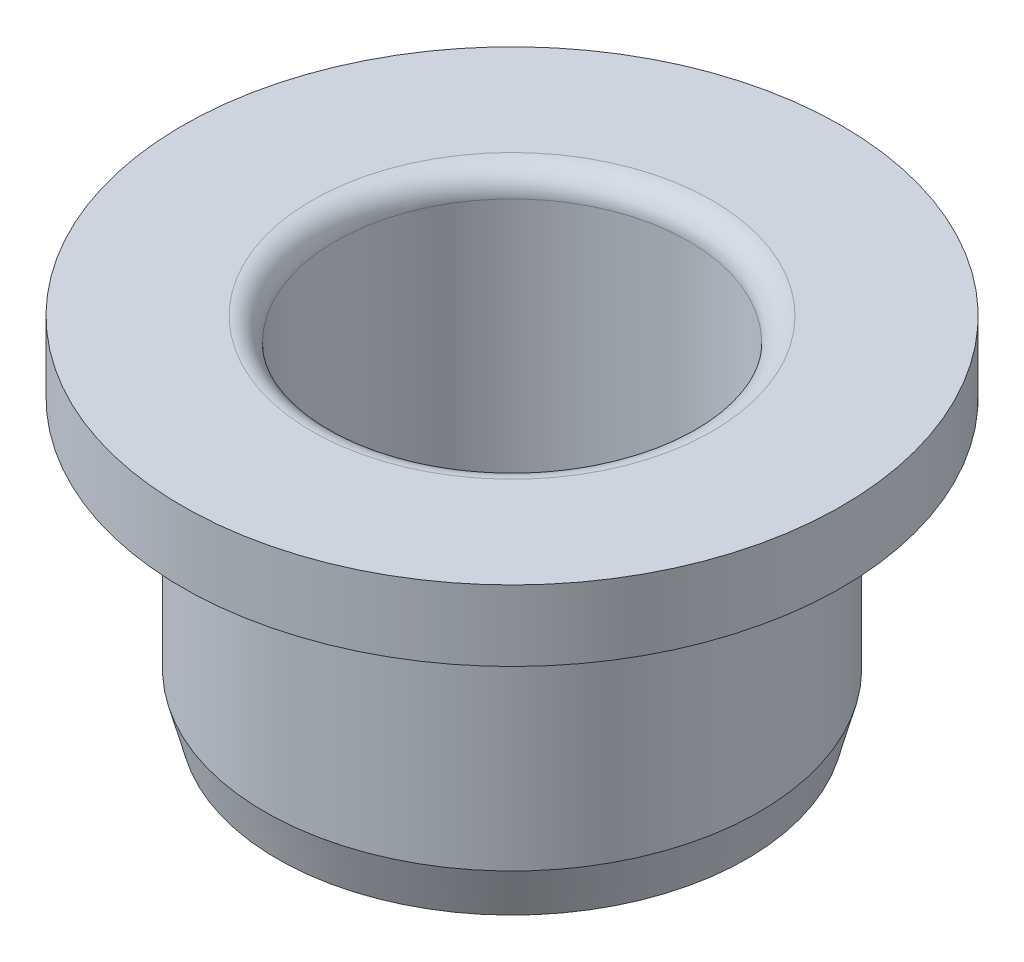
SolidWorks part; units mm, degrees
ref_plane "Plan de face" through (0, 0, 0) normal (0, 0, 1) x (1, 0, 0)
ref_plane "Plan de dessus" through (0, 0, 0) normal (0, 1, 0) x (1, 0, 0)
ref_plane "Plan de droite" through (0, 0, 0) normal (1, 0, 0) x (0, 0, -1)
sketch "Esquisse1" plane through (0, 0, 0) normal (0, 0, 1) x (1, 0, 0)
  line L0 (14, 12) -> (11, 12)
  line L1 (8.5, 0) -> (9.9641, 0)
  line L2 (0, 0) -> (0, 15) construction
  line L3 (8.5, 15) -> (14, 15)
  line L4 (14, 12) -> (14, 15)
  line L5 (10.5, 11.5) -> (10.5, 2)
  line L6 (7.5, 1) -> (7.5, 14)
  line L7 (9.9641, 0) -> (10.5, 2)
  arc A0 (11, 12) -> (10.5, 11.5) centre (11, 11.5) ccw
  arc A1 (8.5, 15) -> (7.5, 14) centre (8.5, 14) ccw
  arc A2 (8.5, 0) -> (7.5, 1) centre (8.5, 1) cw
  dimension "r2" = 0.5
  dimension "r1" = 1
  dimension "d1" = 15
  dimension "ch" = 15
  dimension "d2" = 21
  dimension "d3" = 28
  dimension "l3" = 3
  dimension "l4" = 2
  dimension "l2" = 12
revolve "Révolution1" add sketch "Esquisse1" angle 360 about L2
